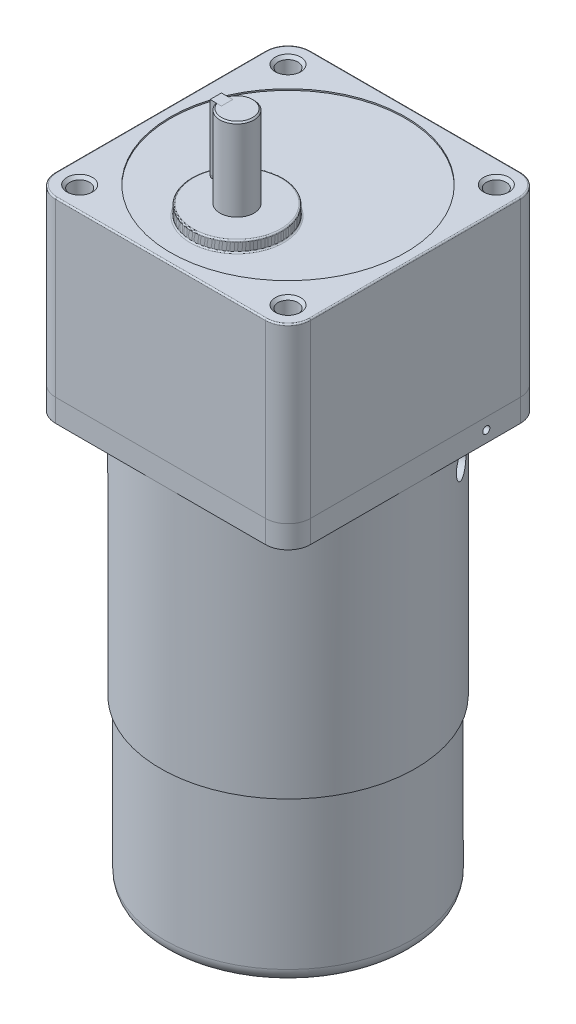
SolidWorks part; units mm, degrees
ref_plane "前视基准面" through (0, 0, 0) normal (0, 0, 1) x (1, 0, 0)
ref_plane "上视基准面" through (0, 0, 0) normal (0, 1, 0) x (1, 0, 0)
ref_plane "右视基准面" through (0, 0, 0) normal (1, 0, 0) x (0, 0, -1)
imported_body "复件 (5) 51k40cc-00机壳 9024.0040.106-00-1-surface1"
imported_body "复件 (5) 51k40cc-00机壳 9024.0040.106-00-1-surface2"
imported_body "9053.0180.101.01箱体-1-surface1"
imported_body "9053.0180.101.01箱体-1-surface2"
imported_body "9053.0180.101.01箱体-1-surface3"
imported_body "9053.0180.101.01箱体-1-surface4"
imported_body "9053.0180.101.01箱体-1-surface5"
sketch "草图1" plane through (0, 129.6087, 0) normal (0, 1, 0) x (1, 0, 0)
  circle A0 centre (-26.1828, -18) radius 16
extrude "凸台-拉伸1" add sketch "草图1" along normal blind 3.8
fillet "圆角1" radius 0.5 1 edges at (-42.1828, 133.4087, 18)
sketch "草图2" plane through (0, 133.4087, 0) normal (0, 1, 0) x (1, 0, 0)
  circle A0 centre (-26.1828, -18) radius 6
extrude "凸台-拉伸2" add sketch "草图2" along normal blind 29
ref_plane "基准面1" through (-32.191, 0, 0) normal (1, 0, 0) x (0, 0, -1)
sketch "草图3" plane through (-32.191, 0, 0) normal (1, 0, 0) x (0, 0, -1)
  line L1 (-12, 162.4087) -> (-24, 162.4087) construction
  line L2 (-16, 139.4087) -> (-16, 162.4087)
  line L3 (-16, 162.4087) -> (-20, 162.4087)
  line L4 (-20, 162.4087) -> (-20, 139.4087)
  arc A0 (-20, 139.4087) -> (-16, 139.4087) centre (-18, 139.4087) ccw
extrude "切除-拉伸1" cut sketch "草图3" along normal blind 2.5
sketch "草图4" plane through (-29.691, 0, 0) normal (-1, 0, 0) x (0, 0, 1)
  line L0 (16, 139.4087) -> (16, 162.4087)
  line L1 (16, 162.4087) -> (20, 162.4087)
  line L2 (20, 162.4087) -> (20, 139.4087)
  arc A0 (16, 139.4087) -> (20, 139.4087) centre (18, 139.4087) ccw
extrude "凸台-拉伸3" add sketch "草图4" along normal blind 4 separate body
chamfer "倒角1" distance 0.5 angle 45 1 edges at (-20.1828, 162.4087, 18)
